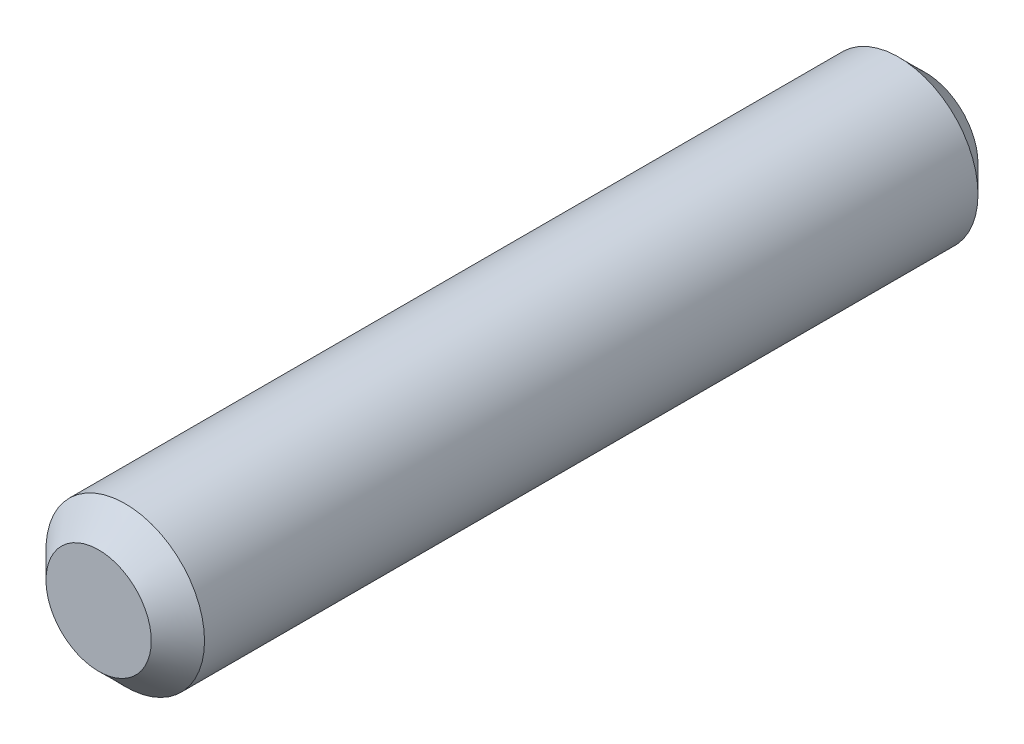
SolidWorks part; units mm, degrees
ref_plane "Спереди" through (0, 0, 0) normal (0, 0, 1) x (1, 0, 0)
ref_plane "Сверху" through (0, 0, 0) normal (0, 1, 0) x (1, 0, 0)
ref_plane "Справа" through (0, 0, 0) normal (1, 0, 0) x (0, 0, -1)
sketch "Эскиз1" plane through (0, 0, 0) normal (1, 0, 0) x (0, 0, -1)
  line L0 (-51.789, 0) -> (57.579, 0) construction
  line L1 (-6.1595, 0.7842) -> (-5.7626, 1.1811)
  line L2 (-6.1595, 0) -> (6.1595, 0)
  line L3 (-6.1595, 0) -> (-6.1595, 0.7842)
  line L4 (-5.7626, 1.1811) -> (5.7626, 1.1811)
  line L5 (6.1595, 0) -> (6.1595, 0.7842)
  line L6 (5.7626, 1.1811) -> (6.1595, 0.7842)
  line L7 (0, 0) -> (0, 5.4622) construction
  point P4 (6.1595, 1.1811)
  point P5 (-6.1595, 1.1811)
  dimension "D1" = 2.3622
  dimension "D2" = 12.319
revolve "Повернуть1" add sketch "Эскиз1" angle 360 about L0
